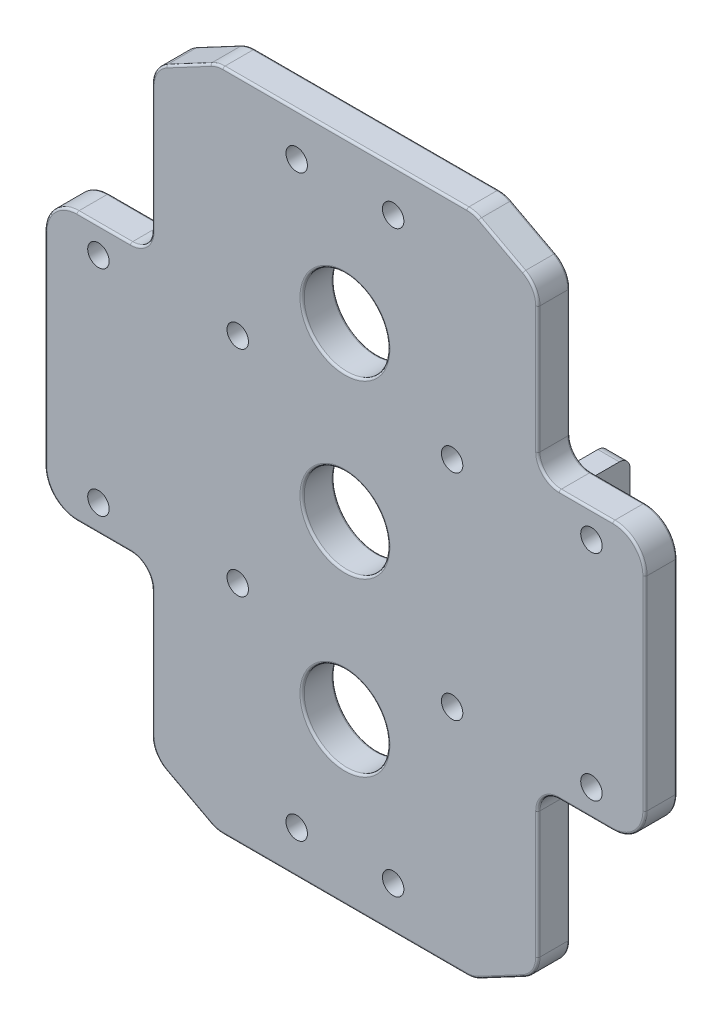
SolidWorks part; units mm, degrees
ref_plane "前视基准面" through (0, 0, 0) normal (0, 0, 1) x (1, 0, 0)
ref_plane "上视基准面" through (0, 0, 0) normal (0, 1, 0) x (1, 0, 0)
ref_plane "右视基准面" through (0, 0, 0) normal (1, 0, 0) x (0, 0, -1)
sketch "草图1" plane through (0, 0, 0) normal (0, 0, 1) x (1, 0, 0)
  line L0 (0, -45.2659) -> (0, 52.1914) construction
  line L1 (61.1983, 0) -> (-53.0667, 0) construction
  line L3 (28, -31) -> (-28, -31)
  line L4 (28, -31) -> (28, 31)
  line L5 (28, 31) -> (-28, 31)
  line L6 (-28, -31) -> (-28, 31)
  line L7 (28, -31) -> (-28, 31) construction
  line L8 (28, 31) -> (-28, -31) construction
  point P4 (0, 0)
extrude "凸台-拉伸" add sketch "草图1" along normal blind 3
sketch "草图3" plane through (0, 0, 3) normal (0, 0, 1) x (1, 0, 0)
  line L0 (0, -31) -> (0, 31) construction
  line L1 (-28, -31) -> (28, -31) construction
  line L2 (28, 31) -> (-28, 31) construction
  line L3 (28, 0) -> (-28, 0) construction
  line L4 (28, -31) -> (28, 31) construction
  line L5 (-28, 31) -> (-28, -31) construction
  line L6 (18, -31) -> (18, -12.5)
  line L7 (28, -31) -> (18, -31)
  line L8 (28, -31) -> (28, -12.5)
  line L9 (28, -12.5) -> (18, -12.5)
  line L10 (28, 12.5) -> (18, 12.5)
  line L11 (28, 31) -> (18, 31)
  line L12 (28, 31) -> (28, 12.5)
  line L13 (18, 31) -> (18, 12.5)
  line L15 (-28, -31) -> (-18, -31)
  line L16 (-28, -31) -> (-28, -12.5)
  line L17 (-28, -12.5) -> (-18, -12.5)
  line L18 (-18, -31) -> (-18, -12.5)
  line L19 (-28, 31) -> (-18, 31)
  line L20 (-28, 31) -> (-28, 12.5)
  line L21 (-28, 12.5) -> (-18, 12.5)
  line L22 (-18, 31) -> (-18, 12.5)
  circle A0 centre (23, -10) radius 1
  circle A1 centre (23, 10) radius 1
  circle A2 centre (-23, 10) radius 1
  circle A3 centre (-23, -10) radius 1
  circle A4 centre (10, -10) radius 1
  circle A5 centre (10, 10) radius 1
  circle A6 centre (-10, 10) radius 1
  circle A7 centre (-10, -10) radius 1
  circle A8 centre (-4.5, 27) radius 1
  circle A10 centre (4.5, 27) radius 1
  circle A12 centre (4.5, -27) radius 1
  circle A13 centre (-4.5, -27) radius 1
  dimension "D1" = 4
  dimension "D3" = 4
extrude "螺丝孔" cut sketch "草图3" against normal blind 3
fillet "小圆角" radius 3 4 edges at (-28, -12.5, 1.5) (-28, 12.5, 1.5) (28, -12.5, 1.5) (28, 12.5, 1.5)
fillet "圆角3" radius 2 4 edges at (-18, -12.5, 1.5) (-18, 12.5, 1.5) (18, -12.5, 1.5) (18, 12.5, 1.5)
sketch "草图4" plane through (0, 0, 3) normal (0, 0, 1) x (1, 0, 0)
  line L0 (28, 0) -> (-28, 0) construction
  line L1 (28, -9.5) -> (28, 9.5) construction
  line L2 (-28, 9.5) -> (-28, -9.5) construction
  line L3 (0, -31) -> (0, 31) construction
  line L4 (18, 31) -> (-18, 31) construction
  line L5 (-18, -31) -> (18, -31) construction
  circle A0 centre (0, 0) radius 4
  circle A1 centre (0, -16) radius 4
  circle A2 centre (0, 16) radius 4
  dimension "D1" = 4
extrude "切除-拉伸2" cut sketch "草图4" against normal blind 10 contours A0 | A1 | A2
sketch "草图6" plane through (0, 0, 0) normal (0, 0, -1) x (-1, 0, 0)
  line L0 (28, 0) -> (-28, 0) construction
  line L1 (0, -31) -> (0, 31) construction
  line L2 (18, -31) -> (-18, -31) construction
  line L3 (-18, 31) -> (18, 31) construction
  line L4 (28, 9.5) -> (28, -9.5) construction
  line L5 (-28, -9.5) -> (-28, 9.5) construction
  line L6 (-19, 11) -> (-17, -11) construction
  line L7 (19, -11) -> (17, -11)
  line L8 (19, -11) -> (19, 11)
  line L9 (19, 11) -> (17, 11)
  line L10 (17, -11) -> (17, 11)
  line L11 (19, -11) -> (17, 11) construction
  line L12 (19, 11) -> (17, -11) construction
  line L13 (-19, -11) -> (-17, 11) construction
  line L14 (-17, -11) -> (-17, 11)
  line L15 (-19, 11) -> (-17, 11)
  line L16 (-19, -11) -> (-19, 11)
  line L17 (-19, -11) -> (-17, -11)
  point P16 (18, 0)
  point P24 (-18, 0)
  dimension "D1" = 18
  dimension "D2" = 22
  dimension "D3" = 2
extrude "凸台-拉伸2" add sketch "草图6" along normal blind 4.6
fillet "圆角4" radius 1 4 edges at (-18, -11, -4.6) (-18, 11, -4.6) (18, 11, -4.6) (18, -11, -4.6)
sketch "草图7" plane through (-19, 0, 0) normal (-1, 0, 0) x (0, 0, 1)
  line L0 (0, 0) -> (-4.6, 0) construction
  line L1 (-4.6, -10) -> (-4.6, 10) construction
  line L5 (-2.5, -5.85) -> (-3.5, -8.95) construction
  line L6 (-2.5, 8.95) -> (-3.5, 8.95)
  line L7 (-2.5, 8.95) -> (-2.5, 5.85)
  line L8 (-2.5, 5.85) -> (-3.5, 5.85)
  line L9 (-3.5, 8.95) -> (-3.5, 5.85)
  line L10 (-2.5, 8.95) -> (-3.5, 5.85) construction
  line L11 (-2.5, 5.85) -> (-3.5, 8.95) construction
  line L12 (-2.5, -8.95) -> (-3.5, -5.85) construction
  line L13 (-3.5, -8.95) -> (-3.5, -5.85)
  line L14 (-2.5, -5.85) -> (-3.5, -5.85)
  line L15 (-2.5, -8.95) -> (-2.5, -5.85)
  line L16 (-2.5, -8.95) -> (-3.5, -8.95)
  point P5 (0, 0)
  point P11 (-3, 7.4)
  point P20 (-3, -7.4)
  dimension "D1" = 1.6
  dimension "D2" = 7.4
  dimension "D3" = 1.6
extrude "电池下挂孔" cut sketch "草图7" against normal blind 44
fillet "圆角5" radius 0.2 24 edges at (18, 8.95, -2.5) (18, 5.85, -2.5) (18, 5.85, -3.5) (18, 8.95, -3.5) (18, -5.85, -2.5) (18, -5.85, -3.5) (18, -8.95, -3.5) (18, -8.95, -2.5) (-18, 5.85, -2.5) (-18, 8.95, -2.5) (-18, 8.95, -3.5) (-18, 5.85, -3.5) (-18, -5.85, -2.5) (-18, -8.95, -2.5) (-18, -5.85, -3.5) (-18, -8.95, -3.5) (-18, -11, 0) (-17, 0, 0) (-18, 11, 0) (-19, 0, 0) (17, 0, 0) (18, -11, 0) (19, 0, 0) (18, 11, 0)
chamfer "倒角1" distance 6 angle 28 4 edges at (18, 31, 1.5) (-18, 31, 1.5) (18, -31, 1.5) (-18, -31, 1.5)
fillet "圆角6" radius 2.5 8 edges at (18, -27.8097, 1.5) (12, -31, 1.5) (-12, -31, 1.5) (-18, -27.8097, 1.5) (-18, 27.8097, 1.5) (-12, 31, 1.5) (12, 31, 1.5) (18, 27.8097, 1.5)
fillet "圆角7" radius 0.2 70 edges at (0, -31, 0) (11.9815, -30.9257, 0) (-11.9815, -30.9257, 0) (14.612, -29.6112, 0) (-14.612, -29.6112, 0) (17.6429, -27.5952, 0) (-17.6429, -27.5952, 0) (18, -20.4038, 0) (-18, -20.4038, 0) (18.5858, -13.0858, 0) (-18.5858, -13.0858, 0) (22.5, -12.5, 0) (-22.5, -12.5, 0) (27.1213, -11.6213, 0) (-27.1213, -11.6213, 0) (28, 0, 0) (-28, 0, 0) (27.1213, 11.6213, 0) (-27.1213, 11.6213, 0) (22.5, 12.5, 0) (-22.5, 12.5, 0) (18.5858, 13.0858, 0) (-18.5858, 13.0858, 0) (18, 20.4038, 0) (-18, 20.4038, 0) (17.6429, 27.5952, 0) (-17.6429, 27.5952, 0) (14.612, 29.6112, 0) (-14.612, 29.6112, 0) (11.9815, 30.9257, 0) (-11.9815, 30.9257, 0) (0, 31, 0) (0, -31, 3) (11.9815, -30.9257, 3) (-11.9815, -30.9257, 3) (14.612, -29.6112, 3) (-14.612, -29.6112, 3) (17.6429, -27.5952, 3) (-17.6429, -27.5952, 3) (18, -20.4038, 3) (-18, -20.4038, 3) (18.5858, -13.0858, 3) (-18.5858, -13.0858, 3) (22.5, -12.5, 3) (-22.5, -12.5, 3) (27.1213, -11.6213, 3) (-27.1213, -11.6213, 3) (28, 0, 3) (-28, 0, 3) (27.1213, 11.6213, 3) (-27.1213, 11.6213, 3) (22.5, 12.5, 3) (-22.5, 12.5, 3) (18.5858, 13.0858, 3) (-18.5858, 13.0858, 3) (18, 20.4038, 3) (-18, 20.4038, 3) (17.6429, 27.5952, 3) (-17.6429, 27.5952, 3) (14.612, 29.6112, 3) (-14.612, 29.6112, 3) (11.9815, 30.9257, 3) (-11.9815, 30.9257, 3) (0, 31, 3) (4, 16, 0) (-4, 16, 3) (4, 0, 0) (4, 0, 3) (4, -16, 0) (4, -16, 3)
